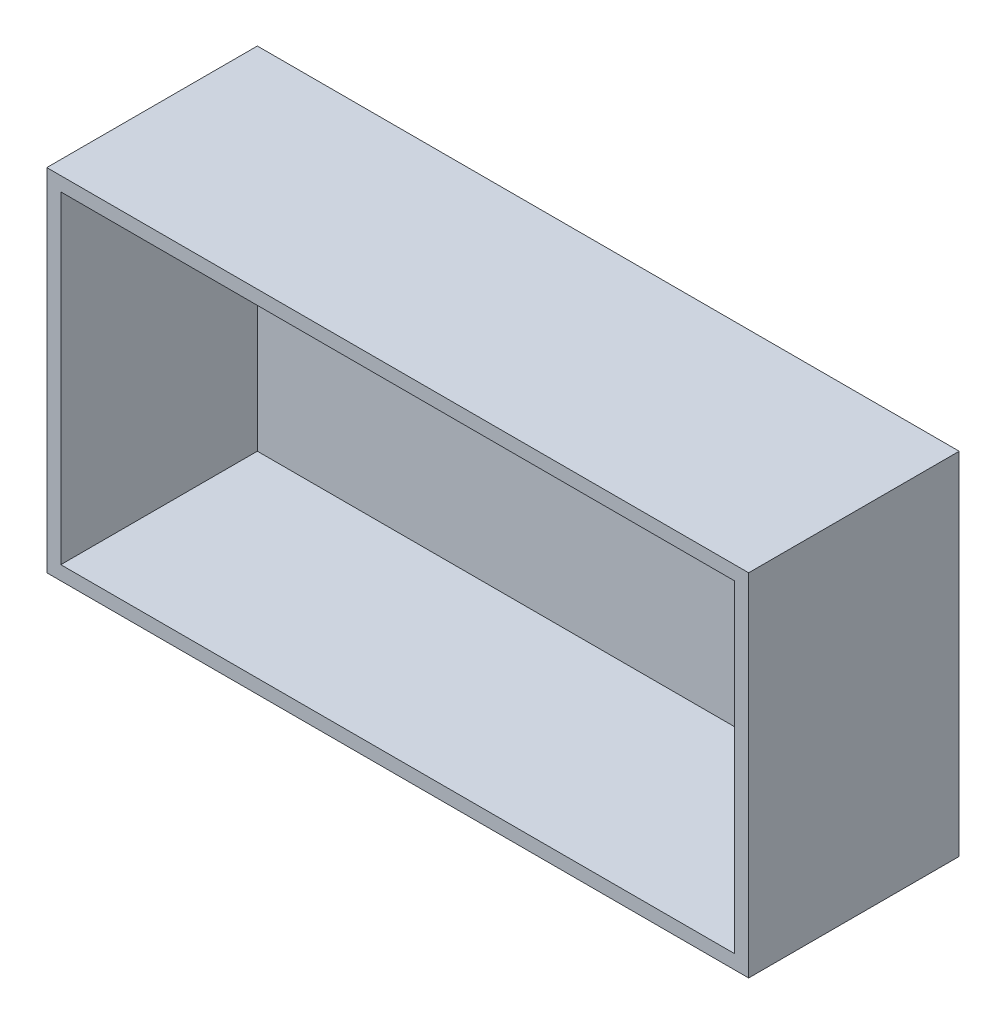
SolidWorks part; units mm, degrees
ref_plane "Front Plane" through (0, 0, 0) normal (0, 0, 1) x (1, 0, 0)
ref_plane "Top Plane" through (0, 0, 0) normal (0, 1, 0) x (1, 0, 0)
ref_plane "Right Plane" through (0, 0, 0) normal (1, 0, 0) x (0, 0, -1)
sketch "Sketch1" plane through (0, 0, 0) normal (0, 0, 1) x (1, 0, 0)
  line L1 (-100, 50) -> (100, 50)
  line L2 (-100, 50) -> (-100, -50)
  line L3 (-100, -50) -> (100, -50)
  line L4 (100, 50) -> (100, -50)
  line L5 (-100, 50) -> (100, -50) construction
  line L6 (-100, -50) -> (100, 50) construction
  point P0 (0, 0)
  dimension "D1" = 200
  dimension "D2" = 100
extrude "Boss-Extrude1" add sketch "Sketch1" along normal blind 60
shell "Shell1" thickness 4
